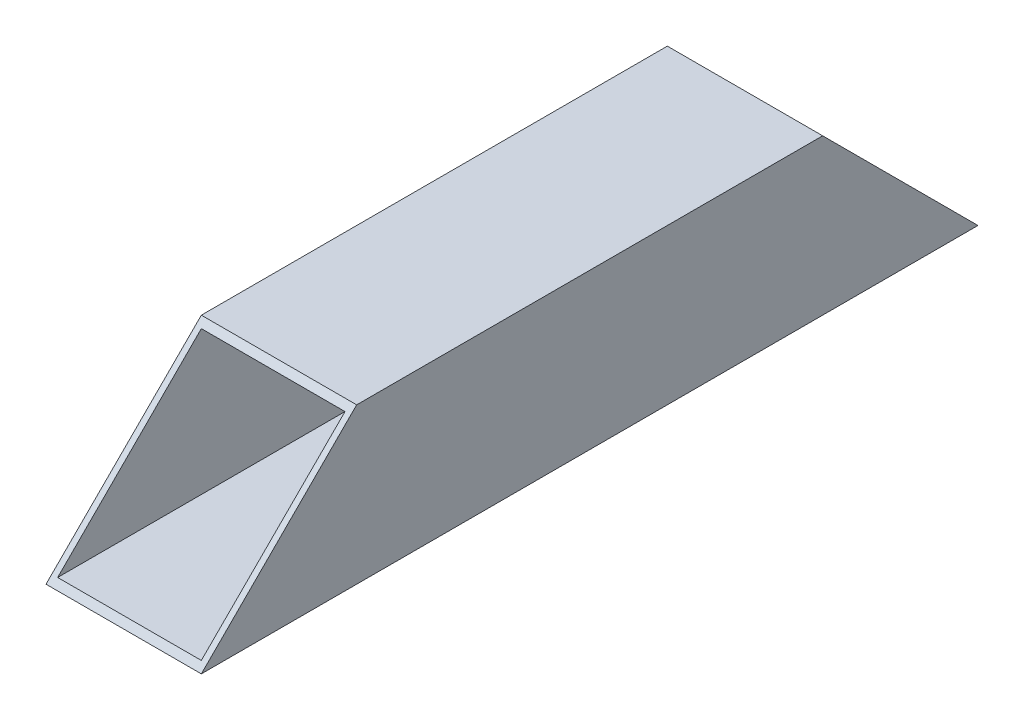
SolidWorks part; units mm, degrees
ref_plane "Plan de face" through (0, 0, 0) normal (0, 0, 1) x (1, 0, 0)
ref_plane "Plan de dessus" through (0, 0, 0) normal (0, 1, 0) x (1, 0, 0)
ref_plane "Plan de droite" through (0, 0, 0) normal (1, 0, 0) x (0, 0, -1)
sketch "Esquisse1" plane through (0, 0, 0) normal (0, 0, 1) x (1, 0, 0)
  line L1 (0, 0) -> (-80, 0)
  line L2 (0, 0) -> (0, 80)
  line L3 (0, 80) -> (-80, 80)
  line L4 (-80, 0) -> (-80, 80)
  line L5 (-77, 77) -> (-3, 77)
  line L6 (-77, 77) -> (-77, 3)
  line L7 (-77, 3) -> (-3, 3)
  line L8 (-3, 77) -> (-3, 3)
  dimension "D1" = 80
  dimension "D2" = 80
  dimension "D3" = 3
  dimension "D4" = 3
  dimension "D5" = 3
  dimension "D6" = 3
extrude "Extrusion1" add sketch "Esquisse1" along normal blind 400
ref_plane "Plan1" through (-80, 80, 0) normal (0, 0, -1) x (-1, 0, 0)
sketch "Esquisse3" plane through (-80, 0, 0) normal (-1, 0, 0) x (0, 0, 1)
  line L0 (0, 80) -> (80, 80)
  line L1 (0, 190) -> (0, -30) construction
  line L2 (400, 80) -> (0, 80) construction
  line L3 (80, 80) -> (0, 0)
  line L4 (0, 0) -> (0, 80)
  line L5 (400, 80) -> (320, 80)
  line L6 (320, 80) -> (400, 0)
  line L7 (400, 0) -> (400, 80)
  dimension "D1" = 80
  dimension "D2" = 80
  dimension "D3" = 80
extrude "Enlèv. mat.-Extru.3" cut sketch "Esquisse3" against normal blind 800
